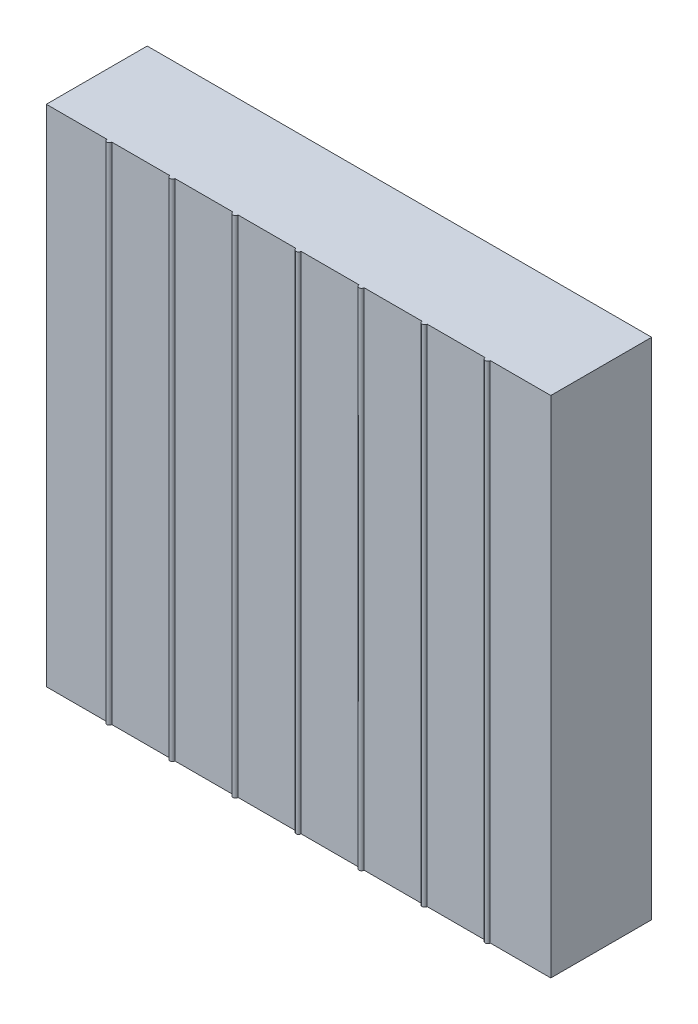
SolidWorks part; units mm, degrees
ref_plane "Face" through (0, 0, 0) normal (0, 0, 1) x (1, 0, 0)
ref_plane "Dessus" through (0, 0, 0) normal (0, 1, 0) x (1, 0, 0)
ref_plane "Droite" through (0, 0, 0) normal (1, 0, 0) x (0, 0, -1)
sketch "Esquisse1" plane through (0, 0, 0) normal (0, 0, 1) x (1, 0, 0)
  line L0 (0, 10) -> (0, -10) construction
  line L1 (-10, 10) -> (10, 10)
  line L2 (-10, 10) -> (-10, -10)
  line L3 (-10, -10) -> (10, -10)
  line L4 (10, 10) -> (10, -10)
  dimension "D1" = 20
extrude "Base-Extrusion" add sketch "Esquisse1" along normal blind 4
sketch "Esquisse3" plane through (0, 10, 0) normal (0, 1, 0) x (-1, 0, 0)
  line L0 (-10, 4) -> (10, 4) construction
  line L1 (-0.1, 4) -> (0.1, 4)
  line L2 (2.4, 4) -> (2.6, 4)
  line L3 (4.9, 4) -> (5.1, 4)
  line L4 (7.4, 4) -> (7.6, 4)
  line L5 (0.1, 4) -> (2.6, 4) construction
  line L6 (-2.6, 4) -> (-2.4, 4)
  line L7 (-5.1, 4) -> (-4.9, 4)
  line L8 (-7.6, 4) -> (-7.4, 4)
  arc A0 (0.1, 4) -> (-0.1, 4) centre (0, 4) ccw
  arc A1 (2.6, 4) -> (2.4, 4) centre (2.5, 4) ccw
  arc A2 (5.1, 4) -> (4.9, 4) centre (5, 4) ccw
  arc A3 (7.6, 4) -> (7.4, 4) centre (7.5, 4) ccw
  arc A4 (-2.4, 4) -> (-2.6, 4) centre (-2.5, 4) ccw
  arc A5 (-4.9, 4) -> (-5.1, 4) centre (-5, 4) ccw
  arc A6 (-7.4, 4) -> (-7.6, 4) centre (-7.5, 4) ccw
  dimension "D1" = 0.2
  dimension "D2" = 2.5
extrude "Boss.-Extru.1" add sketch "Esquisse3" against normal up to surface (20 mm away)
